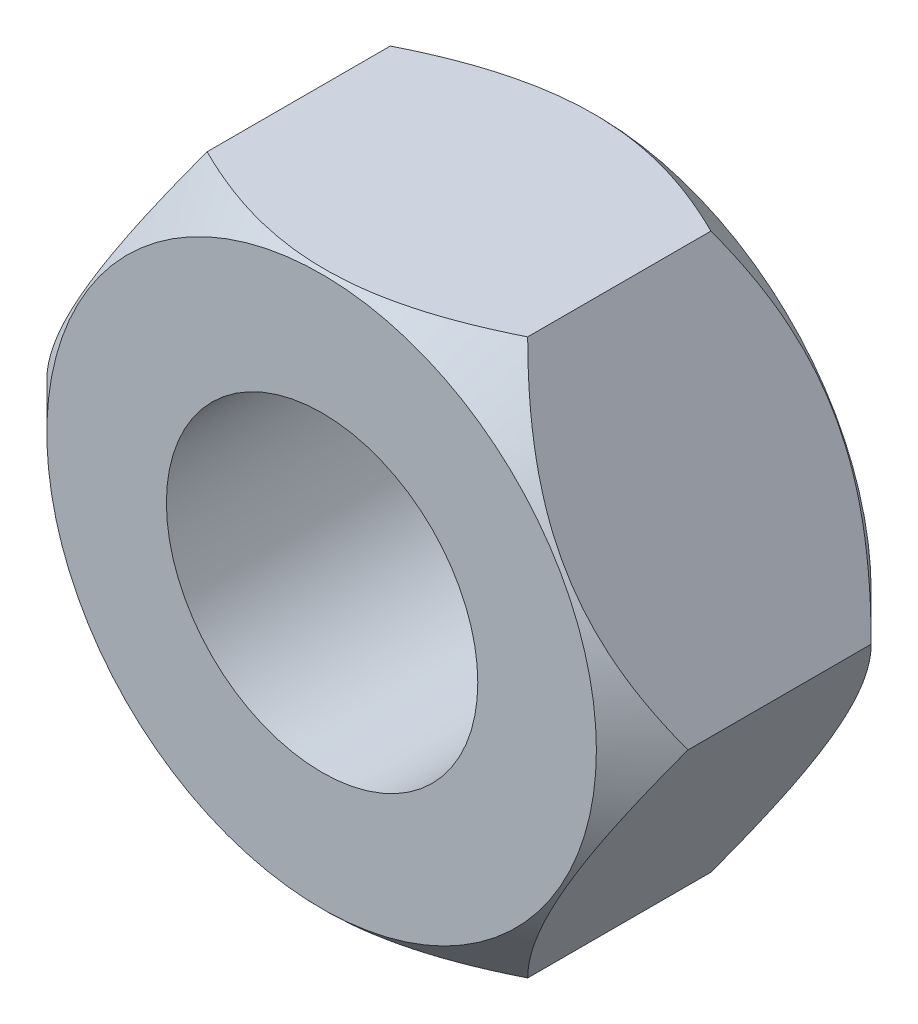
SolidWorks part; units mm, degrees
ref_plane "Face" through (0, 0, 0) normal (0, 0, 1) x (1, 0, 0)
ref_plane "Dessus" through (0, 0, 0) normal (0, 1, 0) x (1, 0, 0)
ref_plane "Droite" through (0, 0, 0) normal (1, 0, 0) x (0, 0, -1)
sketch "Esquisse1" plane through (0, 0, 0) normal (0, 0, 1) x (1, 0, 0)
  circle A0 centre (0, 0) radius 7
extrude "Extrusion1" add sketch "Esquisse1" along normal blind 6
hole_wizard "Trou taraudé M81" positions "Esquisse3" profile "Esquisse2" tap size "M8" standard "ISO"
sketch "Esquisse3" plane through (0, 0, 6) normal (0, 0, 1) x (1, 0, 0)
  point P0 (0.0105, -0.0209)
sketch "Esquisse2" plane through (0.0105, -0.0209, 6) normal (1, 0, 0) x (0, -1, 0)
  line L0 (0, 0) -> (0, 6)
  line L1 (0, 6) -> (3.4, 6)
  line L2 (3.4, 6) -> (3.4, 0)
  line L5 (3.4, 0) -> (0, 0)
  line L11 (0, -6.35) -> (0, 107.95) construction
  dimension "Diamètre du trou pour taraudage jusqu'au prochain" = 6.8
  dimension "Profondeur du trou pour taraudage jusqu'au prochain" = 6
chamfer "Chanfrein1" distance 1 angle 45 2 edges at (7, 0, 0) (7, 0, 6)
sketch "Esquisse4" plane through (0, 0, 6) normal (0, 0, 1) x (1, 0, 0)
  line L1 (7, 0) -> (3.5, 6.0622)
  line L2 (3.5, 6.0622) -> (-3.5, 6.0622)
  line L3 (-3.5, 6.0622) -> (-7, 0)
  line L4 (-7, 0) -> (-3.5, -6.0622)
  line L5 (-3.5, -6.0622) -> (3.5, -6.0622)
  line L6 (3.5, -6.0622) -> (7, 0)
  circle A0 centre (0, 0) radius 6.0622 construction
extrude "Enlèv. mat.-Extru.1" cut sketch "Esquisse4" against normal blind 10 flip side to cut
